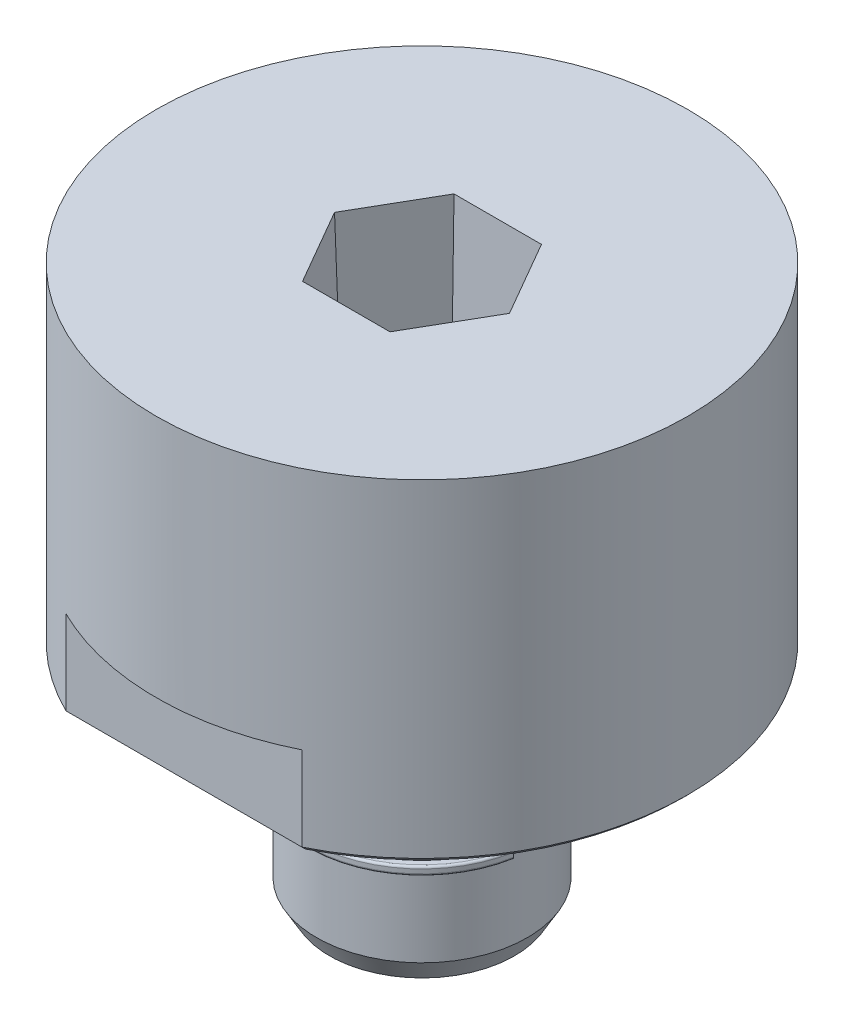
SolidWorks part; units mm, degrees
ref_plane "Front Plane" through (0, 0, 0) normal (0, 0, 1) x (1, 0, 0)
ref_plane "Top Plane" through (0, 0, 0) normal (0, 1, 0) x (1, 0, 0)
ref_plane "Right Plane" through (0, 0, 0) normal (1, 0, 0) x (0, 0, -1)
sketch "Sketch1" plane through (0, 0, 0) normal (0, 0, 1) x (1, 0, 0)
  line L0 (0, 0) -> (0, 48.2526) construction
  line L1 (0, 0) -> (0, 25)
  line L2 (0, 25) -> (11.9975, 25)
  line L3 (11.9975, 25) -> (11.9975, 10)
  line L4 (11.9975, 10) -> (5.56, 10)
  line L5 (4.76, 9.2) -> (4.76, 5)
  line L6 (4.76, 5) -> (4.455, 5)
  line L7 (4.455, 5) -> (4.455, 4.54)
  line L8 (4.455, 4.54) -> (4.76, 4.54)
  line L9 (4.76, 4.54) -> (4.76, 1)
  line L10 (4.76, 1) -> (4.1826, 0)
  line L11 (4.1826, 0) -> (0, 0)
  arc A0 (4.76, 9.2) -> (5.56, 10) centre (5.56, 9.2) cw
  dimension "D7" = 0.8
  dimension "D1" = 30
  dimension "D2" = 1
  dimension "D3" = 8.91
  dimension "D4" = 9.52
  dimension "D5" = 5
  dimension "D6" = 0.46
  dimension "D8" = 10
  dimension "D9" = 15
  dimension "D10" = 23.995
revolve "Revolve1" add sketch "Sketch1" angle 360 about L0
sketch "Sketch2" plane through (0, 10, 0) normal (0, -1, 0) x (1, 0, 0)
  line L0 (-5.3271, 10.75) -> (5.3271, 10.75)
  line L1 (-5.3271, -10.75) -> (5.3271, -10.75)
  line L2 (0, 0) -> (9.119, 0) construction
  arc A0 (-5.3271, -10.75) -> (5.3271, -10.75) centre (0, 0) ccw
  circle A1 centre (0, 0) radius 11.9975 construction
  arc A2 (5.3271, 10.75) -> (-5.3271, 10.75) centre (0, 0) ccw
  dimension "D1" = 21.5
extrude "Cut-Extrude1" cut sketch "Sketch2" against normal blind 4
sketch "Sketch3" plane through (0, 25, 0) normal (0, 1, 0) x (1, 0, 0)
  line L0 (-13.1973, 0) -> (13.1973, 0) construction
  line L1 (1.7321, 3) -> (-1.7321, 3)
  line L2 (-1.7321, 3) -> (-3.4641, 0)
  line L3 (-3.4641, 0) -> (-1.7321, -3)
  line L4 (-1.7321, -3) -> (1.7321, -3)
  line L5 (1.7321, -3) -> (3.4641, 0)
  line L6 (3.4641, 0) -> (1.7321, 3)
  circle A0 centre (0, 0) radius 3 construction
  dimension "D1" = 6
extrude "Cut-Extrude2" cut sketch "Sketch3" against normal blind 12
sketch "Sketch4" plane through (0, 0, 0) normal (0, 0, 1) x (1, 0, 0)
  line L2 (9.2, 10) -> (10.1165, 10)
  line L3 (9.2, 10) -> (9.2, 10.4)
  line L4 (9.2, 10) -> (9.2, 14.0847) construction
  line L5 (5.3271, 10) -> (11.9975, 10) construction
  arc A0 (10.1165, 10) -> (9.2, 10.4) centre (9.2, 9.15) ccw
  dimension "D1" = 9.2
  dimension "D2" = 1.25
  dimension "D3" = 0.4
revolve "Cut-Revolve1" cut sketch "Sketch4" angle 360 about L4
pattern_circular "CirPattern1" count 8 over 360 about axis through (0, 0, 0) along (0, 1, 0) of "Cut-Revolve1"
chamfer "Chamfer1" distance 0.2 angle 45 4 edges at (-11.9975, 10, 0) (11.9975, 10, 0) (0, 10, -10.75) (0, 10, 10.75)
draft "Draft1" type of draft neutral plane draft angle 2 faces to draft 6 parameters "D1"=2
sketch "Sketch5" plane through (0, 0, 0) normal (0, 0, 1) x (1, 0, 0)
  line L2 (11.9975, 25) -> (-11.9975, 25) construction
  line L3 (-4.7373, 25) -> (-3.9147, 20.3346)
  line L5 (3.9147, 20.3346) -> (4.7373, 25)
  line L6 (0, 14) -> (0, 10.2) construction
  line L7 (0, 0) -> (0, 26) construction
  line L8 (-4.7373, 25) -> (4.7373, 25)
  line L11 (-5.3271, 14) -> (5.3271, 14) construction
  arc A0 (-3.9147, 20.3346) -> (3.9147, 20.3346) centre (0, 21.0249) ccw
  dimension "D1" = 7.9502
  dimension "D3" = 3.0498
  dimension "D2" = 10
sketch "Sketch6" plane through (0, 13, 0) normal (0, 1, 0) x (1, 0, 0)
  circle A0 centre (0, 0) radius 2.25
  dimension "D1" = 4.5
extrude "Cut-Extrude3" cut sketch "Sketch6" against normal through all
chamfer "Chamfer2" distance 0.75 1 edges at (0, 0, 2.25)
imported_body "VS_37.sldprt"
move or copy body "Body-Move/Copy2" bodies to move or copy 108 placed by mates yes parameters "D1"=0, "D2"=0, "D3"=0
